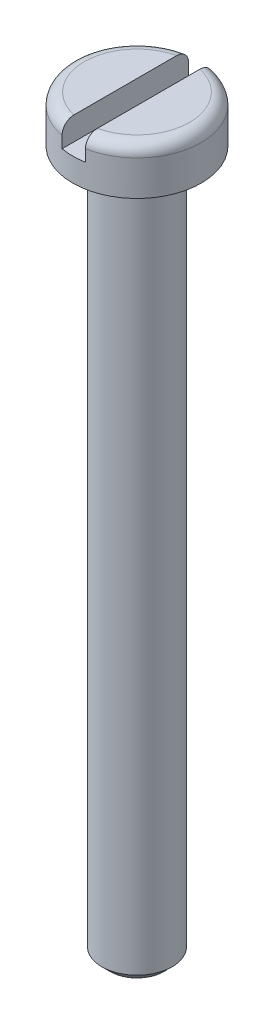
SolidWorks part; units mm, degrees
ref_plane "Plan de face" through (0, 0, 0) normal (0, 0, 1) x (1, 0, 0)
ref_plane "Plan de dessus" through (0, 0, 0) normal (0, 1, 0) x (1, 0, 0)
ref_plane "Plan de droite" through (0, 0, 0) normal (1, 0, 0) x (0, 0, -1)
sketch "Esquisse1" plane through (0, 0, 0) normal (0, 1, 0) x (1, 0, 0)
  circle A0 centre (0, 0) radius 1.5
  dimension "D1" = 3
extrude "Boss.-Extru.1" add sketch "Esquisse1" along normal blind 30
chamfer "Chanfrein1" distance 0.35 angle 45 1 edges at (0, 0, 1.5)
sketch "Esquisse2" plane through (0, 30, 0) normal (0, 1, 0) x (1, 0, 0)
  circle A0 centre (0, 0) radius 2.75
  dimension "D1" = 5.5
extrude "Boss.-Extru.2" add sketch "Esquisse2" along normal blind 2
fillet "Congé1" radius 0.5 1 edges at (0, 32, 2.75)
sketch "Esquisse4" plane through (0, 0, 0) normal (0, 0, 1) x (1, 0, 0)
  line L0 (2.25, 32) -> (-2.25, 32) construction
  line L1 (-0.5, 33) -> (0.5, 33)
  line L2 (-0.5, 33) -> (-0.5, 31)
  line L3 (-0.5, 31) -> (0.5, 31)
  line L4 (0.5, 33) -> (0.5, 31)
  line L5 (-0.5, 33) -> (0.5, 31) construction
  line L6 (-0.5, 31) -> (0.5, 33) construction
  point P0 (0, 32)
  dimension "D1" = 1
  dimension "D2" = 1
extrude "Enlèv. mat.-Extru.1" cut sketch "Esquisse4" against normal through all both and the other way through all
